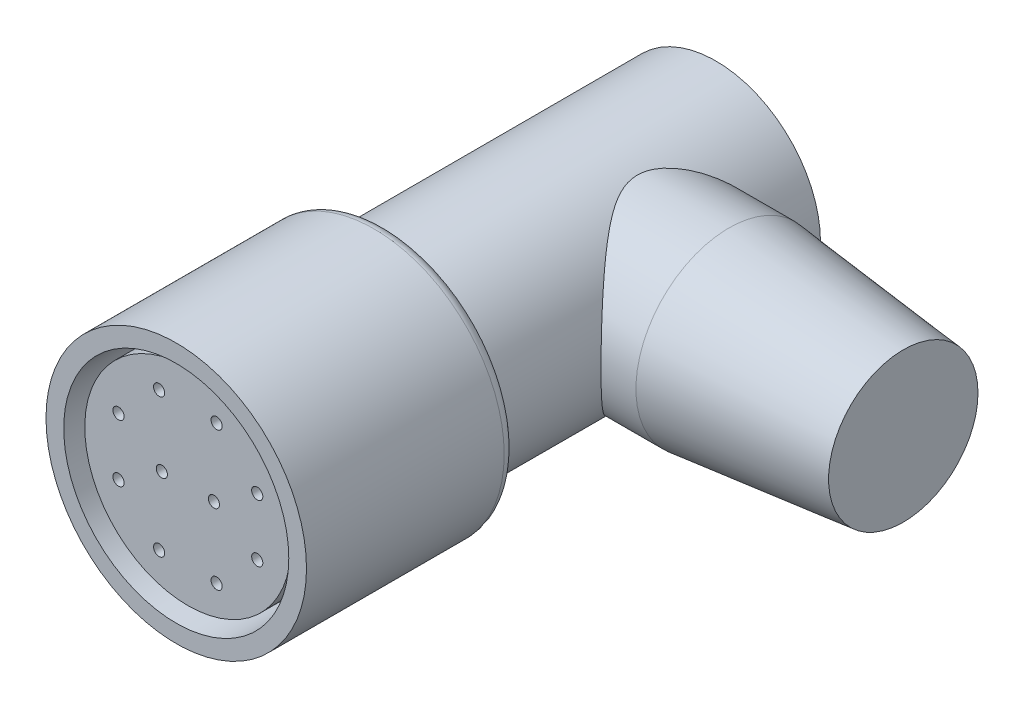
SolidWorks part; units mm, degrees
ref_plane "Front Plane" through (0, 0, 0) normal (0, 0, 1) x (1, 0, 0)
ref_plane "Top Plane" through (0, 0, 0) normal (0, 1, 0) x (1, 0, 0)
ref_plane "Right Plane" through (0, 0, 0) normal (1, 0, 0) x (0, 0, -1)
sketch "Sketch1" plane through (0, 0, 0) normal (0, 0, 1) x (1, 0, 0)
  circle A0 centre (0, 0) radius 8.89
  circle A1 centre (0, 0) radius 7.6811
  dimension "D1" = 17.78
extrude "Boss-Extrude1" add sketch "Sketch1" against normal blind 12.7
sketch "Sketch2" plane through (0, 0, -12.7) normal (0, 0, -1) x (-1, 0, 0)
  circle A0 centre (0, 0) radius 8.89 construction
  circle A1 centre (0, 0) radius 8.89
  circle A2 centre (0, 0) radius 6.7848
extrude "Boss-Extrude2" add sketch "Sketch2" along normal blind 1.5875
sketch "Sketch3" plane through (0, 0, 0) normal (0, 0, 1) x (1, 0, 0)
  line L0 (0, 7.4366) -> (0, 0) construction
  line L1 (-0.3175, 7.4366) -> (0.3175, 7.4366)
  line L2 (-0.3175, 7.4366) -> (-0.3175, 7.0297)
  line L4 (0.3175, 7.4366) -> (0.3175, 7.0297)
  arc A0 (-0.3175, 7.0297) -> (0.3175, 7.0297) centre (0, 0) ccw
  dimension "D1" = 7.0369
  dimension "D2" = 0.635
extrude "Boss-Extrude3" add sketch "Sketch3" against normal blind 11.9062 from offset 0.7937
sketch "Sketch4" plane through (0, 0, -0.7937) normal (0, 0, 1) x (1, 0, 0)
  line L0 (0, 0) -> (4.7348, 1.9612) construction
  line L1 (0, 0) -> (10.2429, 0) construction
  circle A0 centre (4.7348, 1.9612) radius 0.381
  circle A1 centre (0, 0) radius 5.125 construction
  dimension "D2" = 0.762
  dimension "D1" = 22.5
extrude "Cut-Extrude1" cut sketch "Sketch4" against normal blind 10.3187
pattern_circular "CirPattern1" count 8 over 360 about axis through (0, 0, 0) along (0, 0, 1) of "Cut-Extrude1"
sketch "Sketch5" plane through (0, 0, -0.7937) normal (0, 0, 1) x (1, 0, 0)
  circle A0 centre (-1.778, 0) radius 0.381
  circle A1 centre (1.778, 0) radius 0.381
  circle A2 centre (4.7348, 1.9612) radius 0.381 construction
  dimension "D1" = 1.778
  dimension "D2" = 1.778
extrude "Cut-Extrude2" cut sketch "Sketch5" against normal blind 10.3187
sketch "Sketch6" plane through (0, 0, -12.7) normal (0, 0, -1) x (-1, 0, 0)
  circle A2 centre (0, 0) radius 6.1498
  circle A3 centre (0, 0) radius 6.1498
  dimension "D1" = 0.635
extrude "Boss-Extrude4" add sketch "Sketch6" along normal blind 2.3812
sketch "Sketch7" plane through (0, 0, -15.0812) normal (0, 0, -1) x (-1, 0, 0)
  circle A0 centre (0, 0) radius 7.1438
  dimension "D1" = 14.2875
extrude "Boss-Extrude5" add sketch "Sketch7" along normal offset from surface (21.7488 mm away) 36.83
sketch "Sketch8" plane through (0, 0, 0) normal (1, 0, 0) x (0, 0, -1)
  circle A0 centre (28.1986, 0) radius 6.35
  dimension "D1" = 12.7
extrude "Boss-Extrude6" add sketch "Sketch8" along normal blind 9.525
sketch "Sketch9" plane through (9.525, 0, 0) normal (1, 0, 0) x (0, 0, -1)
  circle A1 centre (28.1986, 0) radius 6.35
  circle A2 centre (28.1986, 0) radius 6.35
  dimension "D1" = 0
extrude "Boss-Extrude7" add sketch "Sketch9" along normal blind 11.8999 draft 6
fillet "Fillet1" radius 0.7937 1 edges at (-8.89, 0, -14.2875)
equation "\"Buoyancy\"=\"SW-Volume\"*(\"SW-Density\"-.037062)"
